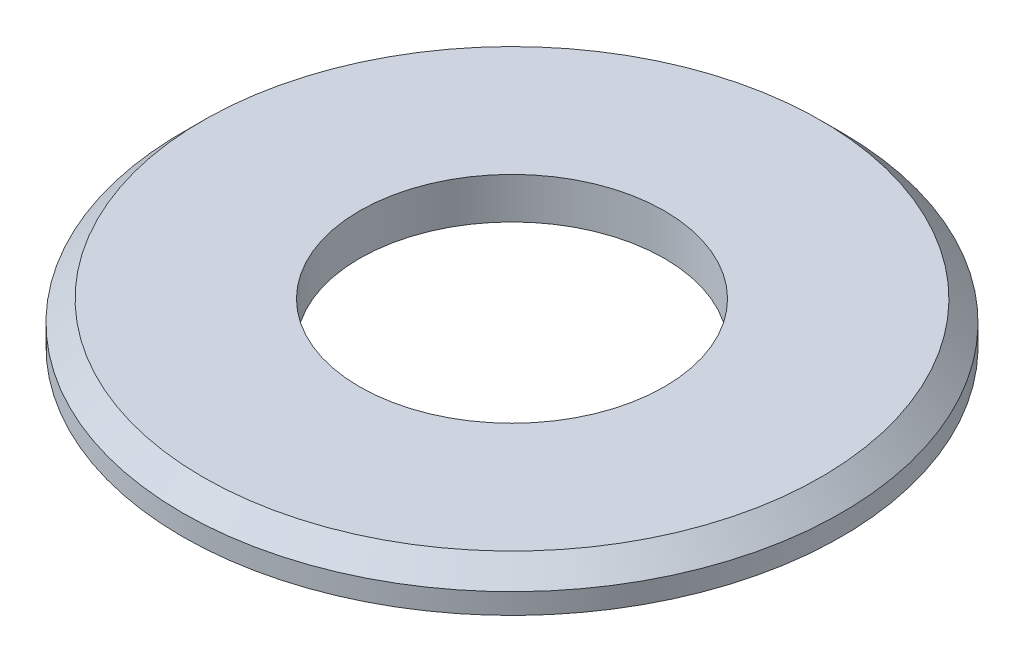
SolidWorks part; units mm, degrees
ref_plane "Front" through (0, 0, 0) normal (0, 0, 1) x (1, 0, 0)
ref_plane "Top" through (0, 0, 0) normal (0, 1, 0) x (1, 0, 0)
ref_plane "Right" through (0, 0, 0) normal (1, 0, 0) x (0, 0, -1)
sketch "Sketch1" plane through (0, 0, 0) normal (0, 1, 0) x (1, 0, 0)
  circle A0 centre (0, 0) radius 1.85
  circle A1 centre (0, 0) radius 4
extrude "Extrude1" add sketch "Sketch1" along normal blind 0.5
chamfer "Chamfer1" distance 0.25 1 edges at (0, 0.5, 4)
